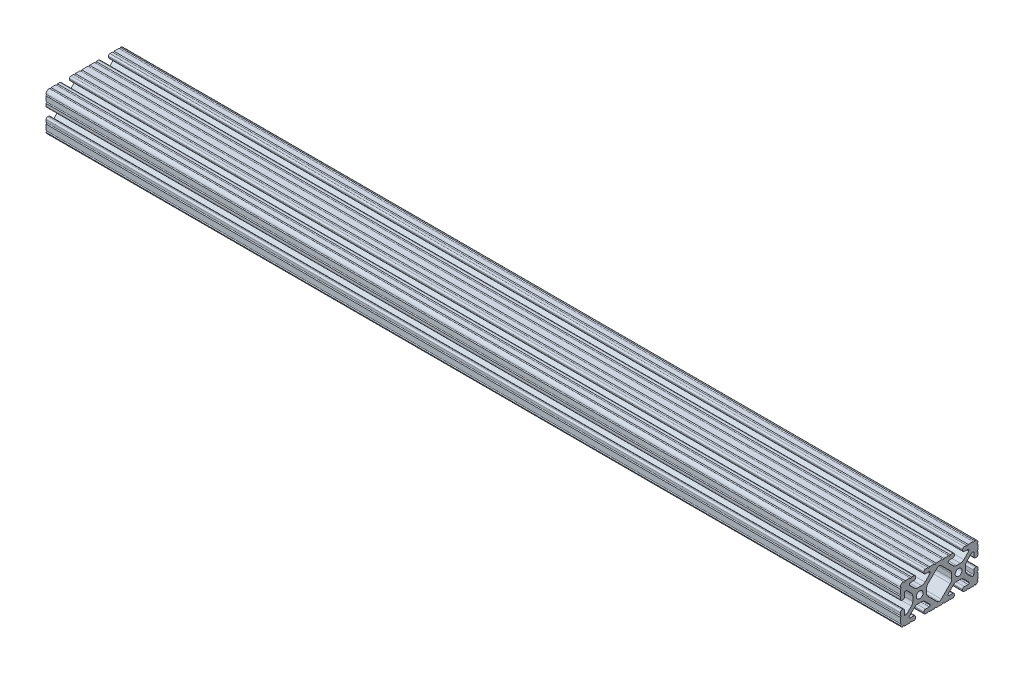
SolidWorks part; units mm, degrees
ref_plane "Front" through (0, 0, 0) normal (0, 0, 1) x (1, 0, 0)
ref_plane "Top" through (0, 0, 0) normal (0, 1, 0) x (1, 0, 0)
ref_plane "Right" through (0, 0, 0) normal (1, 0, 0) x (0, 0, -1)
sketch "Sketch1" plane through (0, 0, 0) normal (1, 0, 0) x (0, 0, -1)
  line L2 (30.3513, 26.5282) -> (39.1767, 35.3536)
  line L3 (40.5679, 38.7122) -> (40.5679, 42.8592)
  line L4 (39.1767, 46.2178) -> (30.3513, 55.0433)
  line L5 (26.1972, 55.0433) -> (17.3719, 46.2178)
  line L6 (15.9807, 42.8592) -> (15.9807, 38.7122)
  line L7 (17.3719, 35.3536) -> (26.1972, 26.5282)
  line L8 (37.19, 54.3201) -> (37.19, 54.8827)
  line L9 (38.079, 55.7717) -> (41.6855, 55.7717)
  line L10 (43.2603, 57.3465) -> (43.2603, 58.2825)
  line L11 (41.707, 59.8357) -> (39.2718, 59.8357)
  line L12 (37.7478, 59.8357) -> (32.9194, 59.8357)
  line L13 (31.3954, 59.8357) -> (25.1532, 59.8357)
  line L14 (23.6292, 59.8357) -> (18.8007, 59.8357)
  line L15 (17.2767, 59.8357) -> (14.8415, 59.8357)
  line L16 (13.2883, 58.2825) -> (13.2883, 57.3465)
  line L17 (14.8631, 55.7717) -> (18.4695, 55.7717)
  line L18 (19.3585, 54.8827) -> (19.3585, 54.3201)
  line L19 (19.0981, 53.6915) -> (14.4218, 49.0151)
  line L20 (11.0632, 47.6239) -> (7.3854, 47.6239)
  line L21 (4.0268, 49.0151) -> (-0.6496, 53.6915)
  line L22 (-0.91, 54.3201) -> (-0.91, 54.8827)
  line L23 (-0.021, 55.7717) -> (3.5855, 55.7717)
  line L24 (5.1603, 57.3465) -> (5.1603, 58.2663)
  line L25 (3.7154, 59.8357) -> (1.3285, 59.8357)
  line L26 (-0.1955, 59.8357) -> (-5.022, 59.8357)
  line L27 (-9.8257, 55.1609) -> (-9.8257, 50.3354)
  line L28 (-9.8257, 48.8114) -> (-9.8257, 46.4245)
  line L29 (-8.2509, 44.8497) -> (-7.3365, 44.8497)
  line L30 (-5.7617, 46.4245) -> (-5.7617, 50.1837)
  line L31 (-4.8727, 51.0727) -> (-4.1464, 51.0727)
  line L32 (-3.5178, 50.8123) -> (1.0767, 46.2178)
  line L33 (2.4679, 42.8592) -> (2.4679, 38.7122)
  line L34 (1.0767, 35.3536) -> (-3.5178, 30.7591)
  line L35 (-4.1464, 30.4987) -> (-4.8727, 30.4987)
  line L36 (-5.7617, 31.3877) -> (-5.7617, 35.1469)
  line L37 (-7.3365, 36.7217) -> (-8.2509, 36.7217)
  line L38 (-9.8257, 35.1469) -> (-9.8257, 32.76)
  line L39 (-9.8257, 31.236) -> (-9.8257, 25.7497)
  line L40 (-5.773, 21.7357) -> (-0.1955, 21.7357)
  line L41 (1.3285, 21.7357) -> (3.5855, 21.7357)
  line L42 (5.1603, 23.3105) -> (5.1603, 24.2249)
  line L43 (3.5855, 25.7997) -> (-0.1737, 25.7997)
  line L44 (-1.0627, 26.6887) -> (-1.0627, 27.0985)
  line L45 (-0.8023, 27.7272) -> (4.0268, 32.5563)
  line L46 (7.3854, 33.9475) -> (11.0632, 33.9475)
  line L47 (14.4218, 32.5563) -> (19.2509, 27.7272)
  line L48 (19.5113, 27.0985) -> (19.5113, 26.6887)
  line L49 (18.6223, 25.7997) -> (14.8631, 25.7997)
  line L50 (13.2883, 24.2249) -> (13.2883, 23.3105)
  line L51 (14.8631, 21.7357) -> (17.2767, 21.7357)
  line L52 (18.8007, 21.7357) -> (23.6292, 21.7357)
  line L53 (25.1532, 21.7357) -> (31.3954, 21.7357)
  line L54 (32.9194, 21.7357) -> (37.7478, 21.7357)
  line L55 (39.2718, 21.7357) -> (41.6855, 21.7357)
  line L56 (43.2603, 23.3105) -> (43.2603, 24.2249)
  line L57 (41.6855, 25.7997) -> (37.9263, 25.7997)
  line L58 (37.0373, 26.6887) -> (37.0373, 27.0985)
  line L59 (37.2977, 27.7272) -> (42.1268, 32.5563)
  line L60 (45.4854, 33.9475) -> (49.1632, 33.9475)
  line L61 (52.5218, 32.5563) -> (57.3509, 27.7272)
  line L62 (57.6113, 27.0985) -> (57.6113, 26.6887)
  line L63 (56.7223, 25.7997) -> (52.9631, 25.7997)
  line L64 (51.3883, 24.2249) -> (51.3883, 23.3105)
  line L65 (52.9631, 21.7357) -> (55.2201, 21.7357)
  line L66 (56.7441, 21.7357) -> (62.3216, 21.7357)
  line L67 (66.3743, 25.7497) -> (66.3743, 31.236)
  line L68 (66.3743, 32.76) -> (66.3743, 35.1469)
  line L69 (64.7995, 36.7217) -> (63.8851, 36.7217)
  line L70 (62.3103, 35.1469) -> (62.3103, 31.3877)
  line L71 (61.4213, 30.4987) -> (60.6949, 30.4987)
  line L72 (60.0663, 30.7591) -> (55.4719, 35.3536)
  line L73 (54.0807, 38.7122) -> (54.0807, 42.8592)
  line L74 (55.4719, 46.2178) -> (60.0663, 50.8123)
  line L75 (60.6949, 51.0727) -> (61.4213, 51.0727)
  line L76 (62.3103, 50.1837) -> (62.3103, 46.4245)
  line L77 (63.8851, 44.8497) -> (64.7995, 44.8497)
  line L78 (66.3743, 46.4245) -> (66.3743, 48.8114)
  line L79 (66.3743, 50.3354) -> (66.3743, 55.1609)
  line L80 (61.5705, 59.8357) -> (56.7441, 59.8357)
  line L81 (55.2201, 59.8357) -> (52.8332, 59.8357)
  line L82 (51.3883, 58.2663) -> (51.3883, 57.3465)
  line L83 (52.9631, 55.7717) -> (56.5695, 55.7717)
  line L84 (57.4585, 54.8827) -> (57.4585, 54.3201)
  line L85 (57.1981, 53.6915) -> (52.5218, 49.0151)
  line L86 (49.1632, 47.6239) -> (45.4854, 47.6239)
  line L87 (42.1268, 49.0151) -> (37.4504, 53.6915)
  arc A0 (39.1767, 35.3536) -> (40.5679, 38.7122) centre (35.8181, 38.7122) ccw
  arc A1 (30.3513, 55.0433) -> (28.2743, 55.8988) centre (28.2858, 52.9778) ccw
  arc A2 (28.2743, 55.8988) -> (26.1972, 55.0433) centre (28.2627, 52.9778) ccw
  arc A3 (17.3719, 46.2178) -> (15.9807, 42.8592) centre (20.7305, 42.8592) ccw
  arc A4 (15.9807, 38.7122) -> (17.3719, 35.3536) centre (20.7305, 38.7122) ccw
  arc A5 (26.1972, 26.5282) -> (28.2743, 25.6726) centre (28.2627, 28.5936) ccw
  arc A6 (28.2743, 25.6726) -> (30.3513, 26.5282) centre (28.2858, 28.5936) ccw
  circle A7 centre (47.3243, 40.7857) radius 3.3274
  circle A8 centre (9.2243, 40.7857) radius 3.3274
  arc A9 (40.5679, 42.8592) -> (39.1767, 46.2178) centre (35.8181, 42.8592) ccw
  arc A10 (38.079, 55.7717) -> (37.19, 54.8827) centre (38.079, 54.8827) ccw
  arc A11 (41.6855, 55.7717) -> (43.2603, 57.3465) centre (41.6855, 57.3465) ccw
  arc A12 (43.2603, 58.2825) -> (41.707, 59.8357) centre (41.707, 58.2825) ccw
  arc A13 (37.7478, 59.8357) -> (39.2718, 59.8357) centre (38.5098, 59.8357) ccw
  arc A14 (31.3954, 59.8357) -> (32.9194, 59.8357) centre (32.1574, 59.8357) ccw
  arc A15 (23.6292, 59.8357) -> (25.1532, 59.8357) centre (24.3912, 59.8357) ccw
  arc A16 (17.2767, 59.8357) -> (18.8007, 59.8357) centre (18.0387, 59.8357) ccw
  arc A17 (14.8415, 59.8357) -> (13.2883, 58.2825) centre (14.8415, 58.2825) ccw
  arc A18 (13.2883, 57.3465) -> (14.8631, 55.7717) centre (14.8631, 57.3465) ccw
  arc A19 (19.3585, 54.8827) -> (18.4695, 55.7717) centre (18.4695, 54.8827) ccw
  arc A20 (19.0981, 53.6915) -> (19.3585, 54.3201) centre (18.4695, 54.3201) ccw
  arc A21 (11.0632, 47.6239) -> (14.4218, 49.0151) centre (11.0632, 52.3737) ccw
  arc A22 (4.0268, 49.0151) -> (7.3854, 47.6239) centre (7.3854, 52.3737) ccw
  arc A23 (-0.91, 54.3201) -> (-0.6496, 53.6915) centre (-0.021, 54.3201) ccw
  arc A24 (-0.021, 55.7717) -> (-0.91, 54.8827) centre (-0.021, 54.8827) ccw
  arc A25 (3.5855, 55.7717) -> (5.1603, 57.3465) centre (3.5855, 57.3465) ccw
  arc A26 (5.1603, 58.2663) -> (3.7154, 59.8357) centre (3.5855, 58.2663) ccw
  arc A27 (-0.1955, 59.8357) -> (1.3285, 59.8357) centre (0.5665, 59.8357) ccw
  arc A28 (-6.5453, 59.8825) -> (-5.022, 59.8357) centre (-5.7836, 59.8591) ccw
  arc A29 (-6.5453, 59.8825) -> (-9.8633, 56.684) centre (-6.6287, 56.6488) ccw
  arc A30 (-9.8257, 55.1609) -> (-9.8633, 56.684) centre (-9.8257, 55.9229) ccw
  arc A31 (-9.8257, 48.8114) -> (-9.8257, 50.3354) centre (-9.8257, 49.5734) ccw
  arc A32 (-9.8257, 46.4245) -> (-8.2509, 44.8497) centre (-8.2509, 46.4245) ccw
  arc A33 (-7.3365, 44.8497) -> (-5.7617, 46.4245) centre (-7.3365, 46.4245) ccw
  arc A34 (-4.8727, 51.0727) -> (-5.7617, 50.1837) centre (-4.8727, 50.1837) ccw
  arc A35 (-3.5178, 50.8123) -> (-4.1464, 51.0727) centre (-4.1464, 50.1837) ccw
  arc A36 (2.4679, 42.8592) -> (1.0767, 46.2178) centre (-2.2819, 42.8592) ccw
  arc A37 (1.0767, 35.3536) -> (2.4679, 38.7122) centre (-2.2819, 38.7122) ccw
  arc A38 (-4.1464, 30.4987) -> (-3.5178, 30.7591) centre (-4.1464, 31.3877) ccw
  arc A39 (-5.7617, 31.3877) -> (-4.8727, 30.4987) centre (-4.8727, 31.3877) ccw
  arc A40 (-5.7617, 35.1469) -> (-7.3365, 36.7217) centre (-7.3365, 35.1469) ccw
  arc A41 (-8.2509, 36.7217) -> (-9.8257, 35.1469) centre (-8.2509, 35.1469) ccw
  arc A42 (-9.8257, 31.236) -> (-9.8257, 32.76) centre (-9.8257, 31.998) ccw
  arc A43 (-9.8257, 24.2257) -> (-9.8257, 25.7497) centre (-9.8257, 24.9877) ccw
  arc A44 (-9.8257, 24.2257) -> (-7.297, 21.7357) centre (-6.6712, 24.9002) ccw
  arc A45 (-5.773, 21.7357) -> (-7.297, 21.7357) centre (-6.535, 21.7357) ccw
  arc A46 (1.3285, 21.7357) -> (-0.1955, 21.7357) centre (0.5665, 21.7357) ccw
  arc A47 (3.5855, 21.7357) -> (5.1603, 23.3105) centre (3.5855, 23.3105) ccw
  arc A48 (5.1603, 24.2249) -> (3.5855, 25.7997) centre (3.5855, 24.2249) ccw
  arc A49 (-1.0627, 26.6887) -> (-0.1737, 25.7997) centre (-0.1737, 26.6887) ccw
  arc A50 (-0.8023, 27.7272) -> (-1.0627, 27.0985) centre (-0.1737, 27.0985) ccw
  arc A51 (7.3854, 33.9475) -> (4.0268, 32.5563) centre (7.3854, 29.1977) ccw
  arc A52 (14.4218, 32.5563) -> (11.0632, 33.9475) centre (11.0632, 29.1977) ccw
  arc A53 (19.5113, 27.0985) -> (19.2509, 27.7272) centre (18.6223, 27.0985) ccw
  arc A54 (18.6223, 25.7997) -> (19.5113, 26.6887) centre (18.6223, 26.6887) ccw
  arc A55 (14.8631, 25.7997) -> (13.2883, 24.2249) centre (14.8631, 24.2249) ccw
  arc A56 (13.2883, 23.3105) -> (14.8631, 21.7357) centre (14.8631, 23.3105) ccw
  arc A57 (18.8007, 21.7357) -> (17.2767, 21.7357) centre (18.0387, 21.7357) ccw
  arc A58 (25.1532, 21.7357) -> (23.6292, 21.7357) centre (24.3912, 21.7357) ccw
  arc A59 (32.9194, 21.7357) -> (31.3954, 21.7357) centre (32.1574, 21.7357) ccw
  arc A60 (39.2718, 21.7357) -> (37.7478, 21.7357) centre (38.5098, 21.7357) ccw
  arc A61 (41.6855, 21.7357) -> (43.2603, 23.3105) centre (41.6855, 23.3105) ccw
  arc A62 (43.2603, 24.2249) -> (41.6855, 25.7997) centre (41.6855, 24.2249) ccw
  arc A63 (37.0373, 26.6887) -> (37.9263, 25.7997) centre (37.9263, 26.6887) ccw
  arc A64 (37.2977, 27.7272) -> (37.0373, 27.0985) centre (37.9263, 27.0985) ccw
  arc A65 (45.4854, 33.9475) -> (42.1268, 32.5563) centre (45.4854, 29.1977) ccw
  arc A66 (52.5218, 32.5563) -> (49.1632, 33.9475) centre (49.1632, 29.1977) ccw
  arc A67 (57.6113, 27.0985) -> (57.3509, 27.7272) centre (56.7223, 27.0985) ccw
  arc A68 (56.7223, 25.7997) -> (57.6113, 26.6887) centre (56.7223, 26.6887) ccw
  arc A69 (52.9631, 25.7997) -> (51.3883, 24.2249) centre (52.9631, 24.2249) ccw
  arc A70 (51.3883, 23.3105) -> (52.9631, 21.7357) centre (52.9631, 23.3105) ccw
  arc A71 (56.7441, 21.7357) -> (55.2201, 21.7357) centre (55.9821, 21.7357) ccw
  arc A72 (63.8456, 21.7357) -> (62.3216, 21.7357) centre (63.0836, 21.7357) ccw
  arc A73 (63.8456, 21.7357) -> (66.3743, 24.2257) centre (63.2122, 24.9079) ccw
  arc A74 (66.3743, 25.7497) -> (66.3743, 24.2257) centre (66.3743, 24.9877) ccw
  arc A75 (66.3743, 32.76) -> (66.3743, 31.236) centre (66.3743, 31.998) ccw
  arc A76 (66.3743, 35.1469) -> (64.7995, 36.7217) centre (64.7995, 35.1469) ccw
  arc A77 (63.8851, 36.7217) -> (62.3103, 35.1469) centre (63.8851, 35.1469) ccw
  arc A78 (61.4213, 30.4987) -> (62.3103, 31.3877) centre (61.4213, 31.3877) ccw
  arc A79 (60.0663, 30.7591) -> (60.6949, 30.4987) centre (60.6949, 31.3877) ccw
  arc A80 (54.0807, 38.7122) -> (55.4719, 35.3536) centre (58.8305, 38.7122) ccw
  arc A81 (55.4719, 46.2178) -> (54.0807, 42.8592) centre (58.8305, 42.8592) ccw
  arc A82 (60.6949, 51.0727) -> (60.0663, 50.8123) centre (60.6949, 50.1837) ccw
  arc A83 (62.3103, 50.1837) -> (61.4213, 51.0727) centre (61.4213, 50.1837) ccw
  arc A84 (62.3103, 46.4245) -> (63.8851, 44.8497) centre (63.8851, 46.4245) ccw
  arc A85 (64.7995, 44.8497) -> (66.3743, 46.4245) centre (64.7995, 46.4245) ccw
  arc A86 (66.3743, 50.3354) -> (66.3743, 48.8114) centre (66.3743, 49.5734) ccw
  arc A87 (66.4119, 56.684) -> (66.3743, 55.1609) centre (66.3743, 55.9229) ccw
  arc A88 (66.4119, 56.684) -> (63.0938, 59.8825) centre (63.1773, 56.6488) ccw
  arc A89 (61.5705, 59.8357) -> (63.0938, 59.8825) centre (62.3322, 59.8591) ccw
  arc A90 (55.2201, 59.8357) -> (56.7441, 59.8357) centre (55.9821, 59.8357) ccw
  arc A91 (52.8332, 59.8357) -> (51.3883, 58.2663) centre (52.9631, 58.2663) ccw
  arc A92 (51.3883, 57.3465) -> (52.9631, 55.7717) centre (52.9631, 57.3465) ccw
  arc A93 (57.4585, 54.8827) -> (56.5695, 55.7717) centre (56.5695, 54.8827) ccw
  arc A94 (57.1981, 53.6915) -> (57.4585, 54.3201) centre (56.5695, 54.3201) ccw
  arc A95 (49.1632, 47.6239) -> (52.5218, 49.0151) centre (49.1632, 52.3737) ccw
  arc A96 (42.1268, 49.0151) -> (45.4854, 47.6239) centre (45.4854, 52.3737) ccw
  arc A97 (37.19, 54.3201) -> (37.4504, 53.6915) centre (38.079, 54.3201) ccw
extrude "Extrude1" add sketch "Sketch1" along normal blind 838.2
sketch "Sketch3" plane through (0, 21.7357, 0) normal (0, -1, 0) x (1, 0, 0)
  line L0 (838.2, 9.8257) -> (0, 9.8257) construction
  line L1 (0, -7.3854) -> (0, -11.0632) construction
  line L2 (0, -45.4854) -> (0, -49.1632) construction
  line L5 (838.2, -11.0632) -> (838.2, -7.3854) construction
  line L6 (838.2, -45.4854) -> (838.2, -49.1632) construction
  circle A0 centre (19.05, -9.2243) radius 3.5719
  circle A1 centre (19.05, -47.3243) radius 3.5719
  circle A2 centre (819.15, -9.2243) radius 3.5719
  circle A3 centre (819.15, -47.3243) radius 3.5719
  point P4 (0, -9.2243)
  point P9 (0, -47.3243)
  point P16 (838.2, -9.2243)
  point P19 (838.2, -47.3243)
  dimension "D1" = 7.1437
  dimension "D4" = 7.1437
  dimension "D7" = 7.1437
  dimension "D8" = 7.1437
  dimension "D2" = 19.05
  dimension "D3" = 19.05
  dimension "D5" = 19.05
  dimension "D6" = 38.1
  dimension "D9" = 19.05
  dimension "D10" = 19.05
  dimension "D11" = 19.05
  dimension "D12" = 38.1
extrude "Extrude2" cut sketch "Sketch3" against normal blind 38.1
